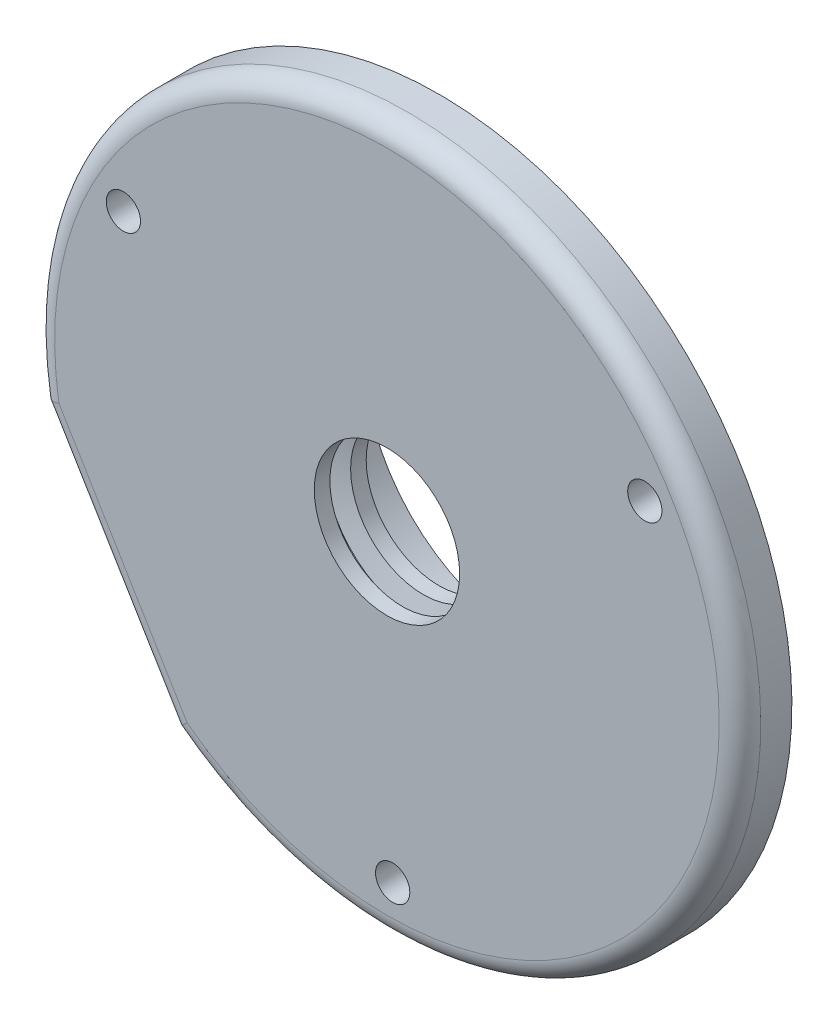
SolidWorks part; units mm, degrees
ref_plane "前视基准面" through (0, 0, 0) normal (0, 0, 1) x (1, 0, 0)
ref_plane "上视基准面" through (0, 0, 0) normal (0, 1, 0) x (1, 0, 0)
ref_plane "右视基准面" through (0, 0, 0) normal (1, 0, 0) x (0, 0, -1)
sketch "草图1" plane through (0, 0, 0) normal (0, 0, 1) x (1, 0, 0)
  circle A1 centre (0, 0) radius 15.704
  circle A3 centre (0, 0) radius 20
  dimension "D1" = 31.408
  dimension "D2" = 40
extrude "拉伸1" add sketch "草图1" along normal offset from surface (8.5 mm away) 2
sketch "草图2" plane through (0, 0, 8.5) normal (0, 0, 1) x (1, 0, 0)
  line L0 (-33.5035, -5.7894) -> (-20.7585, -26.9274)
  arc A0 (-20.7585, -26.9274) -> (-33.5035, -5.7894) centre (0, 0) ccw
  circle A1 centre (0, 0) radius 7
  dimension "D2" = 14
extrude "拉伸3" add sketch "草图2" along normal blind 5
hole_wizard "M4 螺纹孔1" positions "草图4" profile "草图3" tap size "M4" standard "ISO"
sketch "草图4" plane through (0, 0, 13.5) normal (0, 0, 1) x (1, 0, 0)
  point P1 (-25.3854, 14.0207)
  point P4 (24.835, 14.9741)
  point P7 (0.5504, -28.9948)
sketch "草图3" plane through (-25.3854, 14.0207, 13.5) normal (1, 0, 0) x (0, -1, 0)
  line L0 (0, 0) -> (0, 13.5)
  line L1 (0, 13.5) -> (1.65, 13.5)
  line L2 (1.65, 13.5) -> (1.65, 0)
  line L5 (1.65, 0) -> (0, 0)
  line L11 (0, -6.35) -> (0, 107.95) construction
  dimension "籵謂蹟恇謂郰芛眻噤" = 3.3
  dimension "籵謂蹟恇謂郰芛旮僅" = 13.5
fillet "圆角1" radius 2 2 edges at (-27.131, -16.3584, 13.5) (29.1169, 17.5558, 13.5)
sketch "草图5" plane through (0, 0, 0) normal (0, 1, 0) x (1, 0, 0)
  line L0 (-35.7152, -11) -> (35.6066, -11) construction
  line L1 (0, 0) -> (0, -24.3924) construction
  line L2 (34, -8.5) -> (-34, -8.5) construction
  line L3 (-32, -13.5) -> (32, -13.5) construction
  line L4 (7, -12) -> (7, -10)
  line L5 (7, -10) -> (9, -10.5)
  line L6 (9, -10.5) -> (9, -11.5)
  line L7 (7, -12) -> (9, -11.5)
  point P14 (9, -11)
  point P15 (7, -11)
  dimension "D1" = 14
  dimension "D2" = 2
  dimension "D3" = 2
  dimension "D4" = 1
revolve "切除-旋转1" cut sketch "草图5" angle 360 about L1
